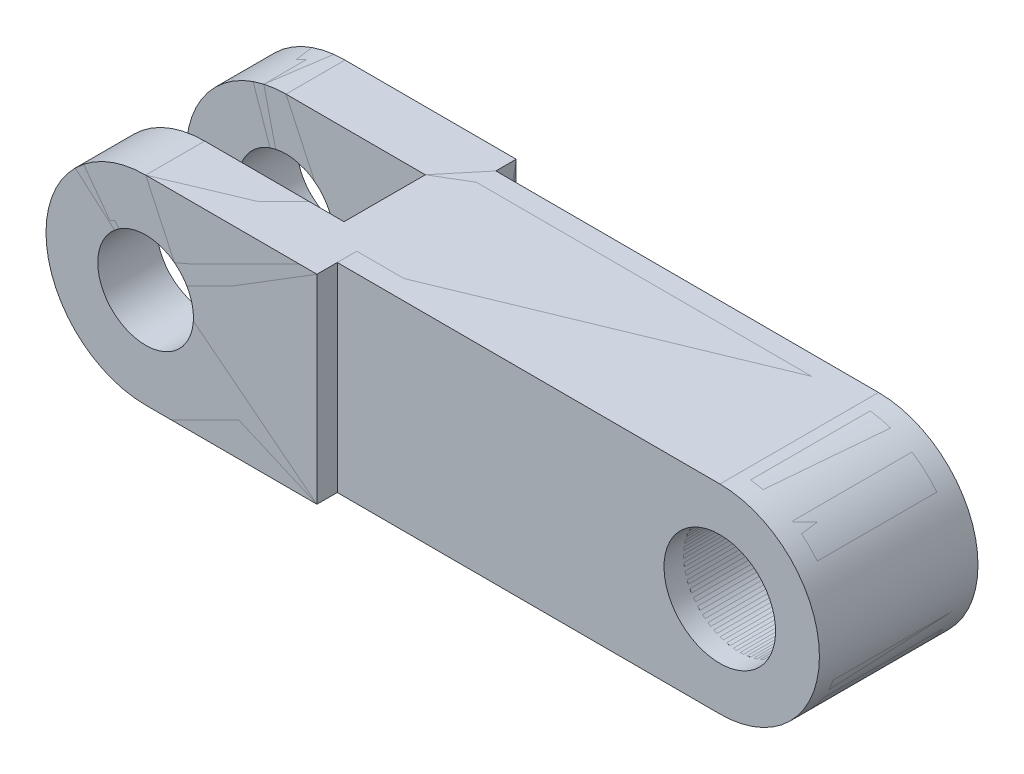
SolidWorks part; units mm, degrees
ref_plane "Face" through (0, 0, 0) normal (0, 0, 1) x (1, 0, 0)
ref_plane "Dessus" through (0, 0, 0) normal (0, 1, 0) x (1, 0, 0)
ref_plane "Droite" through (0, 0, 0) normal (1, 0, 0) x (0, 0, -1)
imported_body "Importée1"
sketch "Esquisse1" plane through (0, 0, -2.55) normal (0, 0, 1) x (1, 0, 0)
  line L0 (-53.5, 12.4708) -> (-53.5, -12.5293) construction
  line L1 (-53.5, 28.7285) -> (12.7617, 28.7285)
  line L2 (-53.5, 28.7285) -> (-53.5, -27.9014)
  line L3 (-53.5, -27.9014) -> (12.7617, -27.9014)
  line L4 (12.7617, 28.7285) -> (12.7617, -27.9014)
extrude "Enlèv. mat.-Extru.1" cut sketch "Esquisse1" against normal blind 2.45
sketch "Esquisse2" plane through (0, 0, -22.45) normal (0, 0, -1) x (-1, 0, 0)
  line L0 (53.5, 12.4708) -> (53.5, -12.5293) construction
  line L1 (53.5, 34.6201) -> (-12.4875, 34.6201)
  line L2 (53.5, 34.6201) -> (53.5, -33.9496)
  line L3 (53.5, -33.9496) -> (-12.4875, -33.9496)
  line L4 (-12.4875, 34.6201) -> (-12.4875, -33.9496)
extrude "Enlèv. mat.-Extru.2" cut sketch "Esquisse2" against normal blind 2.45
